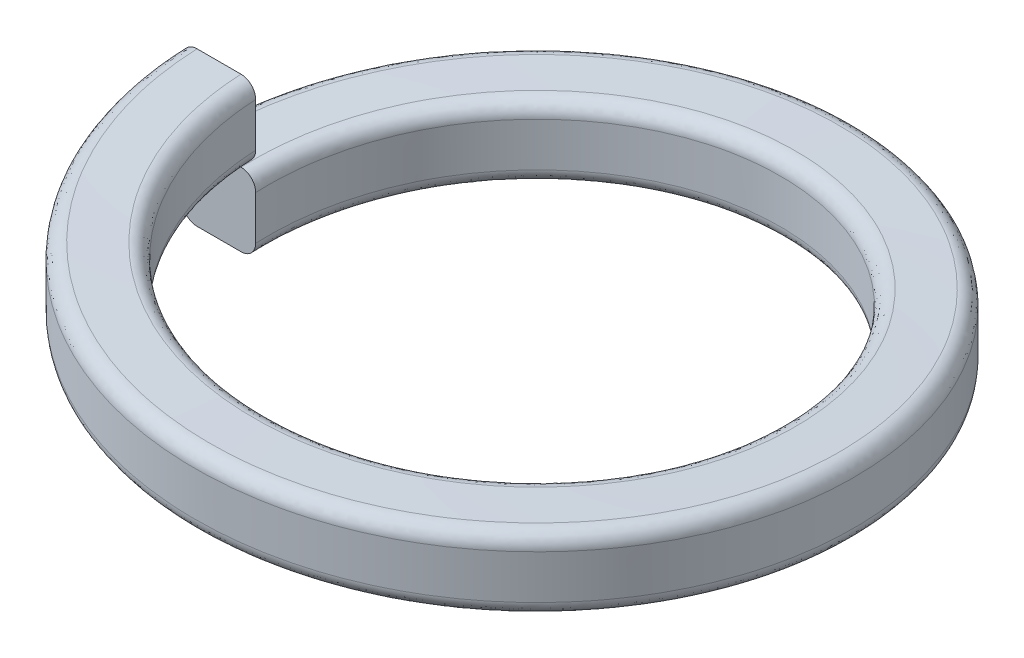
SolidWorks part; units mm, degrees
ref_plane "前视基准面" through (0, 0, 0) normal (0, 0, 1) x (1, 0, 0)
ref_plane "上视基准面" through (0, 0, 0) normal (0, 1, 0) x (1, 0, 0)
ref_plane "右视基准面" through (0, 0, 0) normal (1, 0, 0) x (0, 0, -1)
sketch "草图1" plane through (0, 0, 0) normal (0, 1, 0) x (1, 0, 0)
  circle A0 centre (0, 0) radius 4
  dimension "D1" = 8
curve "螺旋线/涡状线1"
sketch "草图2" plane through (0, 0, 0) normal (0, 0, 1) x (1, 0, 0)
  line L1 (-4.5, 0.5) -> (-3.5, 0.5)
  line L2 (-4.5, 0.5) -> (-4.5, -0.5)
  line L3 (-4.5, -0.5) -> (-3.5, -0.5)
  line L4 (-3.5, 0.5) -> (-3.5, -0.5)
  line L5 (-4.5, 0.5) -> (-3.5, -0.5) construction
  line L6 (-4.5, -0.5) -> (-3.5, 0.5) construction
  spline S0 degree 3 poles (-4, 0) (-4, 0.0228) (-3.7917, 0.0688) (-2.9021, 0.1375) (-1.5706, 0.2063) (0, 0.275) (1.5706, 0.3438) (2.9021, 0.4125) (3.7917, 0.4813) (4.1041, 0.55) (3.7917, 0.6187) (2.9021, 0.6875) (1.5706, 0.7562) (0, 0.825) (-1.5706, 0.8937) (-2.9021, 0.9625) (-3.7917, 1.0312) (-4, 1.0772) (-4, 1.1) knots 0 0 0 0 0.0625 0.125 0.1875 0.25 0.3125 0.375 0.4375 0.5 0.5625 0.625 0.6875 0.75 0.8125 0.875 0.9375 1 1 1 1 construction
  point P0 (-4, 0)
  dimension "D1" = 1
  dimension "D2" = 1
sweep "扫描1" add profiles "草图2" path "螺旋线/涡状线1"
fillet "圆角1" radius 0.2 4 edges
